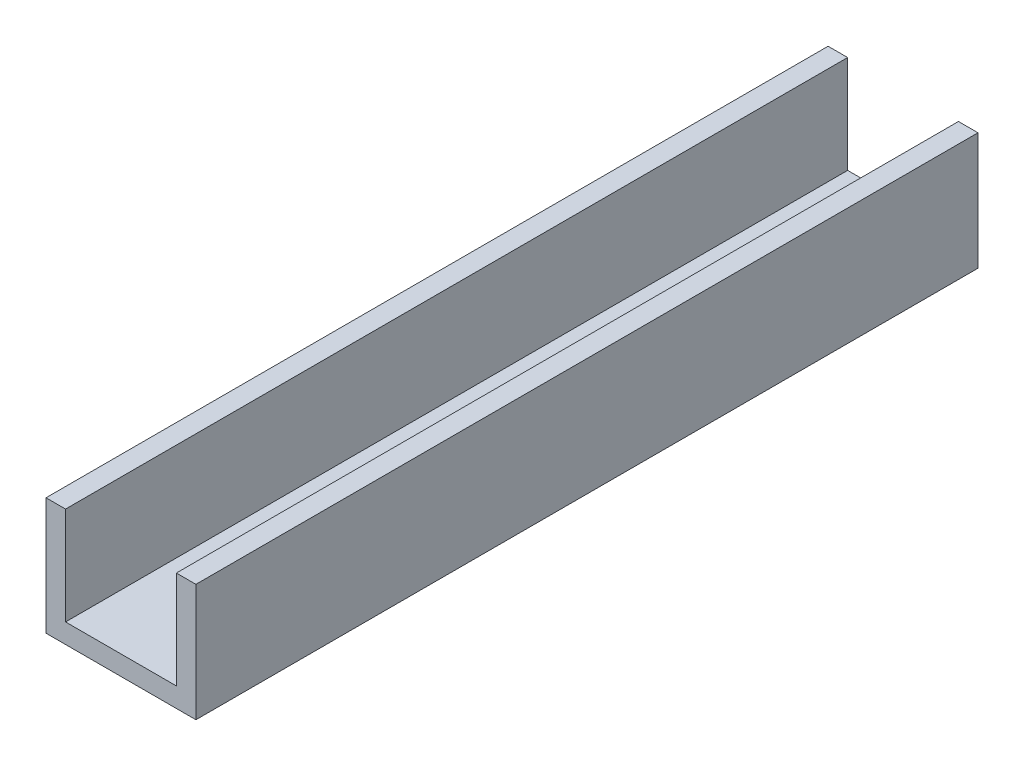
SolidWorks part; units mm, degrees
ref_plane "Front Plane" through (0, 0, 0) normal (0, 0, 1) x (1, 0, 0)
ref_plane "Top Plane" through (0, 0, 0) normal (0, 1, 0) x (1, 0, 0)
ref_plane "Right Plane" through (0, 0, 0) normal (1, 0, 0) x (0, 0, -1)
sketch "Sketch1" plane through (0, 0, 0) normal (0, 0, 1) x (1, 0, 0)
  line L0 (8.5, 7.5) -> (11.5, 7.5)
  line L2 (-8.5, 7.5) -> (-8.5, -7.5)
  line L3 (-8.5, -7.5) -> (8.5, -7.5)
  line L4 (8.5, 7.5) -> (8.5, -7.5)
  line L5 (-8.5, 7.5) -> (8.5, -7.5) construction
  line L6 (-8.5, -7.5) -> (8.5, 7.5) construction
  line L7 (11.5, 7.5) -> (11.5, -10.5)
  line L8 (-11.5, -10.5) -> (11.5, -10.5)
  line L9 (-11.5, 7.5) -> (-11.5, -10.5)
  line L10 (-11.5, 7.5) -> (-8.5, 7.5)
  line L11 (-11.5, 10.5) -> (-11.5, -10.5) construction
  line L12 (11.5, 10.5) -> (11.5, -10.5) construction
  line L13 (-11.5, 10.5) -> (11.5, 10.5) construction
  line L14 (-8.5, 7.5) -> (8.5, 7.5) construction
  point P0 (0, 0)
  dimension "D1" = 17
  dimension "D2" = 15
  dimension "D3" = 3
extrude "Boss-Extrude1" add sketch "Sketch1" along normal blind 120
sketch "Sketch2" plane through (0, -10.5, 0) normal (0, -1, 0) x (1, 0, 0)
  line L0 (-11.5, 0) -> (11.5, 0) construction
  line L1 (-11.5, 120) -> (-11.5, 0) construction
  circle A0 centre (0, 20) radius 1.5
  circle A1 centre (0, 35) radius 1.5
  dimension "D1" = 3
  dimension "D4" = 11.5
  dimension "D5" = 3
  dimension "D2" = 20
  dimension "D3" = 15
extrude "Cut-Extrude1" cut sketch "Sketch2" against normal blind 1
